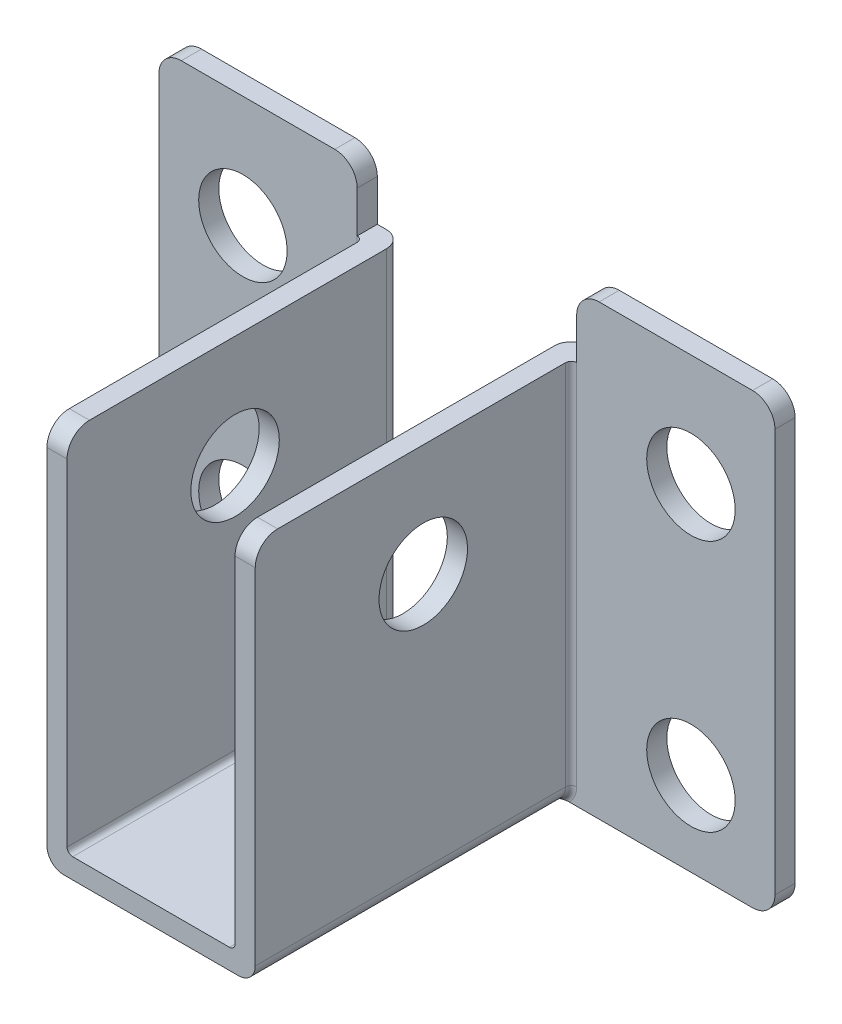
SolidWorks part; units mm, degrees
ref_plane "Front" through (0, 0, 0) normal (0, 0, 1) x (1, 0, 0)
ref_plane "Top" through (0, 0, 0) normal (0, 1, 0) x (1, 0, 0)
ref_plane "Right" through (0, 0, 0) normal (1, 0, 0) x (0, 0, -1)
sketch "Sketch1" plane through (0, 0, 0) normal (0, 0, 1) x (1, 0, 0)
  line L0 (-9.525, 0) -> (9.525, 0) construction
  line L1 (9.525, 50.8) -> (34.925, 50.8)
  line L2 (9.525, 50.8) -> (9.525, 0)
  line L3 (9.525, 0) -> (34.925, 0)
  line L4 (34.925, 50.8) -> (34.925, 0)
  line L5 (-34.925, 50.8) -> (-9.525, 50.8)
  line L6 (-34.925, 50.8) -> (-34.925, 0)
  line L7 (-34.925, 0) -> (-9.525, 0)
  line L8 (-9.525, 50.8) -> (-9.525, 0)
  dimension "Max Panel Thickness" = 19.05
  dimension "C" = 69.85
  dimension "B" = 50.8
extrude "Boss-Extrude1" add sketch "Sketch1" along normal blind 2.286
sketch "Sketch3" plane through (0, 0, 0) normal (0, 0, 1) x (1, 0, 0)
  line L0 (-9.525, 2.286) -> (9.525, 2.286)
  line L1 (-11.811, 43.561) -> (-9.525, 43.561)
  line L2 (-11.811, 43.561) -> (-11.811, 0)
  line L3 (-9.525, 0) -> (-9.525, 50.8) construction
  line L4 (-9.525, 43.561) -> (-9.525, 2.286)
  line L5 (9.525, 43.561) -> (11.811, 43.561)
  line L6 (9.525, 43.561) -> (9.525, 2.286)
  line L7 (9.525, 50.8) -> (9.525, 0) construction
  line L8 (11.811, 43.561) -> (11.811, 0)
  line L9 (0, 0) -> (0, 2.286) construction
  line L11 (-11.811, 0) -> (11.811, 0)
extrude "Boss-Extrude2" add sketch "Sketch3" along normal blind 38.1
fillet "Fillet3" radius 1.905 4 edges at (11.811, 0, 20.193) (-11.811, 0, 20.193) (9.525, 26.543, 0) (-9.525, 26.543, 0)
fillet "Fillet2" radius 0.635 8 edges at (-9.525, 2.286, 20.0025) (9.525, 2.286, 20.0025) (-11.811, 22.733, 2.286) (11.811, 22.733, 2.286) (-11.253, 0.558, 2.286) (11.253, 0.558, 2.286) (-10.083, 2.286, 0.558) (10.083, 2.286, 0.558)
sketch "Sketch5" plane through (0, 0, 0) normal (0, 0, 1) x (1, 0, 0)
  line L0 (34.925, 50.8) -> (9.525, 50.8) construction
  line L1 (-12.446, 43.561) -> (12.446, 43.561)
  line L2 (-12.446, 43.561) -> (-12.446, 50.8)
  line L3 (-12.446, 50.8) -> (12.446, 50.8)
  line L4 (12.446, 43.561) -> (12.446, 50.8)
extrude "Cut-Extrude4" cut sketch "Sketch5" along normal through all
fillet "Fillet4" radius 2.54 8 edges at (34.925, 0, 1.143) (10.668, 43.561, 38.1) (-10.668, 43.561, 38.1) (-34.925, 0, 1.143) (34.925, 50.8, 1.143) (12.446, 50.8, 1.143) (-12.446, 50.8, 1.143) (-34.925, 50.8, 1.143)
sketch "Sketch6" plane through (0, 0, 0) normal (0, 0, 1) x (1, 0, 0)
  line L0 (-14.986, 50.8) -> (-32.385, 50.8) construction
  line L1 (-25.4, 38.1) -> (25.4, 38.1) construction
  line L2 (-25.4, 38.1) -> (-25.4, 9.525) construction
  line L3 (-25.4, 9.525) -> (25.4, 9.525) construction
  line L4 (25.4, 38.1) -> (25.4, 9.525) construction
  circle A0 centre (-25.4, 38.1) radius 5.0165
  circle A1 centre (25.4, 38.1) radius 5.0165
  circle A2 centre (25.4, 9.525) radius 5.0165
  circle A3 centre (-25.4, 9.525) radius 5.0165
  point P10 (0, 38.1)
extrude "Cut-Extrude5" cut sketch "Sketch6" along normal through all
sketch "Sketch7" plane through (0, 0, 0) normal (1, 0, 0) x (0, 0, -1)
  line L0 (-1.905, 2.286) -> (-38.1, 2.286) construction
  line L1 (-38.1, 1.905) -> (-38.1, 41.021) construction
  circle A0 centre (-19.05, 30.861) radius 5.0165
extrude "Cut-Extrude6" cut sketch "Sketch7" against normal through all and the other way through all
sketch "Sketch8" plane through (0, 0, 0) normal (0, 1, 0) x (1, 0, 0)
  line L0 (11.811, -14.0335) -> (9.525, -14.0335) construction
  line L1 (-9.525, -14.0335) -> (-11.811, -14.0335) construction
  line L2 (9.525, -24.0665) -> (11.811, -24.0665) construction
  line L3 (-11.811, -24.0665) -> (-9.525, -24.0665) construction
  line L4 (11.811, -14.0335) -> (9.525, -14.0335)
  line L5 (-9.525, -14.0335) -> (-11.811, -14.0335)
  line L6 (9.525, -24.0665) -> (11.811, -24.0665)
  line L7 (-11.811, -24.0665) -> (-9.525, -24.0665)
  line L8 (-12.827, -19.05) -> (-8.509, -19.05) construction
  line L9 (9.525, -19.05) -> (11.811, -19.05) construction
  line L10 (8.509, -19.05) -> (12.827, -19.05) construction
  line L11 (9.525, -1.905) -> (9.525, -38.1) construction
  line L12 (11.811, -35.56) -> (11.811, -2.921) construction
  line L13 (-11.811, -35.56) -> (-11.811, -2.921) construction
  dimension "D1" = 1.016
  dimension "D2" = 1.016
  dimension "D3" = 1.016
sketch "Sketch9" plane through (0, 0, 0) normal (0, 0, 1) x (1, 0, 0)
  line L0 (9.525, 25.8445) -> (11.811, 25.8445) construction
  line L1 (-11.811, 25.8445) -> (-9.525, 25.8445) construction
  line L2 (-9.525, 35.8775) -> (-11.811, 35.8775) construction
  line L3 (11.811, 35.8775) -> (9.525, 35.8775) construction
  line L4 (9.525, 25.8445) -> (11.811, 25.8445)
  line L5 (-11.811, 25.8445) -> (-9.525, 25.8445)
  line L6 (-9.525, 35.8775) -> (-11.811, 35.8775)
  line L7 (11.811, 35.8775) -> (9.525, 35.8775)
  line L8 (-12.827, 30.861) -> (-8.509, 30.861) construction
  line L9 (9.525, 30.861) -> (11.811, 30.861) construction
  line L10 (8.509, 30.861) -> (12.827, 30.861) construction
equation "\"D1@Sketch3\" = \"Thickness (Stock Check)@Boss-Extrude1\""
equation "\"D1@Sketch7\" = \"Hole Size@Sketch6\""
